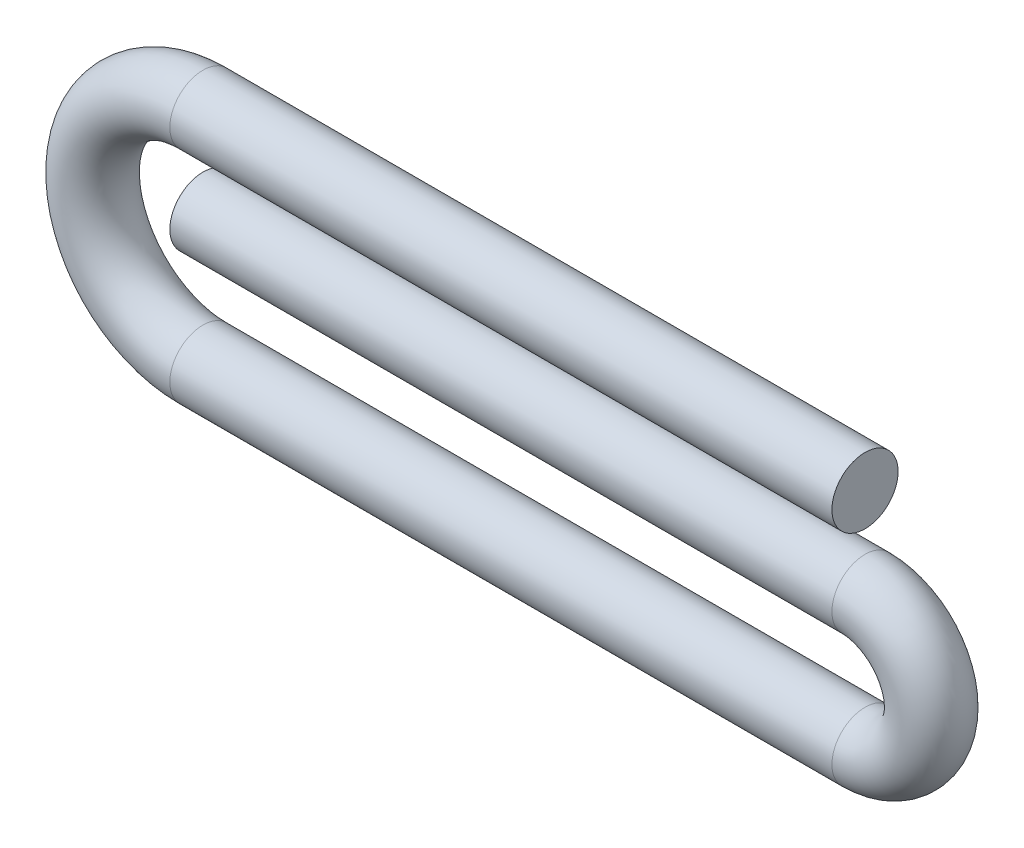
SolidWorks part; units mm, degrees
ref_plane "Front Plane" through (0, 0, 0) normal (0, 0, 1) x (1, 0, 0)
ref_plane "Top Plane" through (0, 0, 0) normal (0, 1, 0) x (1, 0, 0)
ref_plane "Right Plane" through (0, 0, 0) normal (1, 0, 0) x (0, 0, -1)
sketch "Sketch1" plane through (0, 0, 0) normal (0, 0, 1) x (1, 0, 0)
  line L0 (0, 0) -> (30, 0)
  line L1 (30, -6) -> (0, -6)
  line L2 (0, 4) -> (30, 4)
  arc A0 (30, 0) -> (30, -6) centre (30, -3) cw
  arc A1 (0, -6) -> (0, 4) centre (0, -1) cw
  dimension "D3" = 3
  dimension "D4" = 5
  dimension "D1" = 30
  dimension "D2" = 30
sketch "Sketch2" plane through (0, 0, 0) normal (1, 0, 0) x (0, 0, -1)
  circle A0 centre (0, 0) radius 1.5
  dimension "D1" = 3
sweep "Sweep1" add profiles "Sketch2" path "Sketch1"
